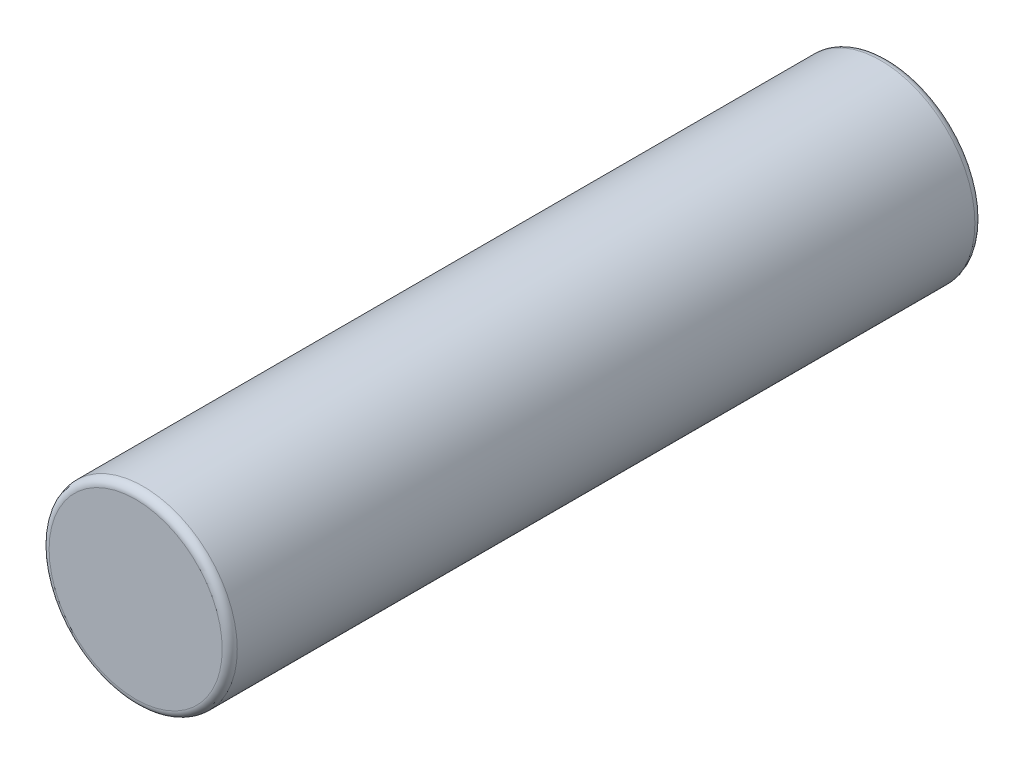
SolidWorks part; units mm, degrees
ref_plane "Face" through (0, 0, 0) normal (0, 0, 1) x (1, 0, 0)
ref_plane "Dessus" through (0, 0, 0) normal (0, 1, 0) x (1, 0, 0)
ref_plane "Droite" through (0, 0, 0) normal (1, 0, 0) x (0, 0, -1)
sketch "Esquisse1" plane through (0, 0, 0) normal (0, 0, 1) x (1, 0, 0)
  circle A0 centre (0, 0) radius 2.5
  dimension "D1" = 5
extrude "Extrusion1" add sketch "Esquisse1" along normal mid plane 20
fillet "Congé1" radius 0.2
